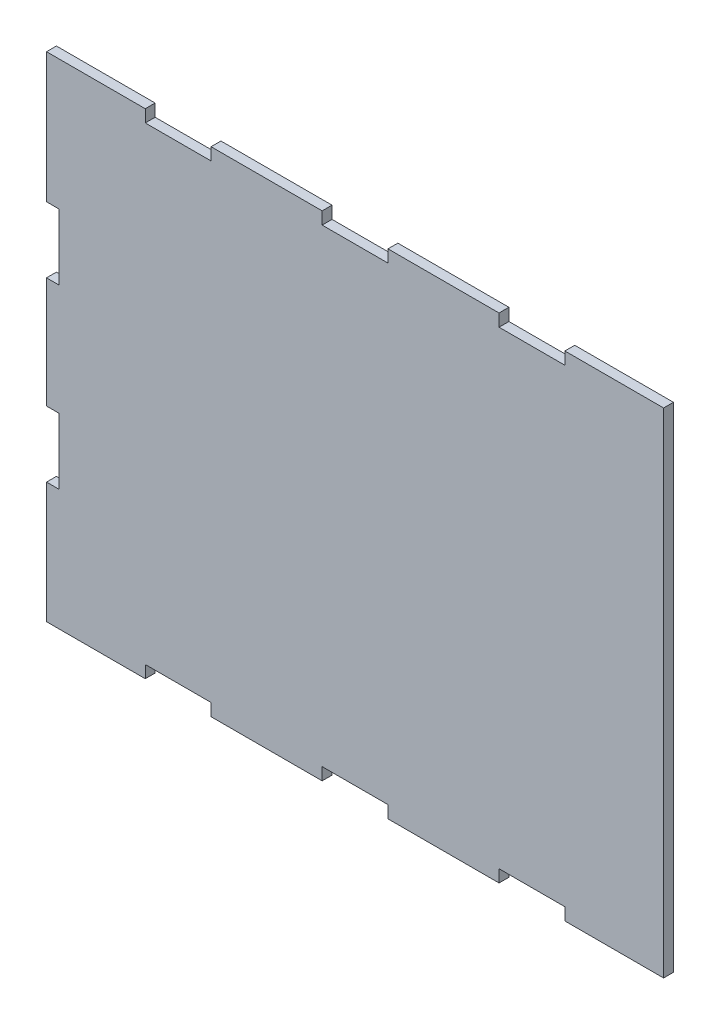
SolidWorks part; units mm, degrees
ref_plane "Alzado" through (0, 0, 0) normal (0, 0, 1) x (1, 0, 0)
ref_plane "Planta" through (0, 0, 0) normal (0, 1, 0) x (1, 0, 0)
ref_plane "Vista lateral" through (0, 0, 0) normal (1, 0, 0) x (0, 0, -1)
sketch "Croquis1" plane through (0, 0, 0) normal (0, 0, 1) x (1, 0, 0)
  line L0 (-375, 0) -> (375, 0) construction
  line L1 (375, -300) -> (255, -300)
  line L2 (375, -300) -> (375, 300)
  line L3 (375, 300) -> (255, 300)
  line L4 (-375, -300) -> (-375, -153)
  line L5 (375, -300) -> (-375, 300) construction
  line L6 (375, 300) -> (-375, -300) construction
  line L8 (-255, 300) -> (-255, 285)
  line L9 (-255, 285) -> (-175, 285)
  line L10 (-175, 300) -> (-175, 285)
  line L12 (-40, 300) -> (-40, 285)
  line L13 (-40, 285) -> (40, 285)
  line L14 (40, 300) -> (40, 285)
  line L16 (175, 300) -> (175, 285)
  line L17 (175, 285) -> (255, 285)
  line L18 (255, 300) -> (255, 285)
  line L19 (255, -300) -> (255, -285)
  line L20 (175, -285) -> (255, -285)
  line L21 (175, -300) -> (175, -285)
  line L22 (40, -300) -> (40, -285)
  line L23 (-40, -285) -> (40, -285)
  line L24 (-40, -300) -> (-40, -285)
  line L25 (-175, -300) -> (-175, -285)
  line L26 (-255, -285) -> (-175, -285)
  line L27 (-255, -300) -> (-255, -285)
  line L28 (-255, 300) -> (-375, 300)
  line L29 (-40, 300) -> (-175, 300)
  line L30 (175, 300) -> (40, 300)
  line L31 (-255, -300) -> (-375, -300)
  line L32 (-40, -300) -> (-175, -300)
  line L33 (175, -300) -> (40, -300)
  line L34 (-375, -73) -> (-375, 62)
  line L35 (-375, 142) -> (-360, 142)
  line L37 (-375, 62) -> (-360, 62)
  line L38 (-360, 142) -> (-360, 62)
  line L39 (-375, -73) -> (-360, -73)
  line L41 (-375, -153) -> (-360, -153)
  line L42 (-360, -73) -> (-360, -153)
  line L43 (-375, 142) -> (-375, 300)
  point P0 (0, 0)
  point P19 (0, 285)
  dimension "D1" = 750
  dimension "D2" = 600
  dimension "D3" = 15
  dimension "D4" = 80
  dimension "D5" = 80
  dimension "D6" = 80
  dimension "D7" = 15
  dimension "D8" = 135
  dimension "D9" = 135
  dimension "D10" = 80
  dimension "D11" = 80
  dimension "D12" = 135
  dimension "D13" = 147
extrude "Saliente-Extruir1" add sketch "Croquis1" along normal blind 12
